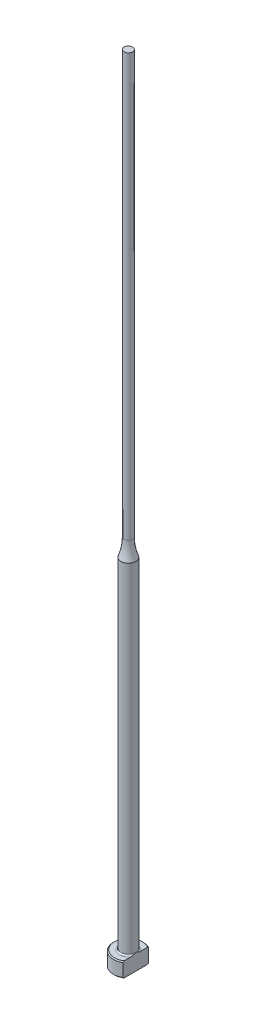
SolidWorks part; units mm, degrees
ref_plane "Front Plane" through (0, 0, 0) normal (0, 0, 1) x (1, 0, 0)
ref_plane "Top Plane" through (0, 0, 0) normal (0, 1, 0) x (1, 0, 0)
ref_plane "Right Plane" through (0, 0, 0) normal (1, 0, 0) x (0, 0, -1)
sketch "Sketch1" plane through (0, 0, 0) normal (0, 0, 1) x (1, 0, 0)
  line L0 (0, 259.9588) -> (0, -15.1925) construction
  line L1 (0, 0) -> (-3, 0)
  line L2 (-3, 0) -> (-3, 3)
  line L3 (-3, 3) -> (-1.5, 3)
  line L4 (-0.85, 75) -> (-0.85, 160)
  line L5 (-0.85, 160) -> (0, 160)
  line L6 (0, 160) -> (0, 0)
  line L7 (-1.5, 3) -> (-1.5, 71.4535)
  arc A0 (-1.5, 71.4535) -> (-0.85, 75) centre (-10.85, 75) ccw
  point P13 (-1.5, 0)
  dimension "D1" = 10
  dimension "L" = 160
  dimension "H" = 6
  dimension "T" = 3
  dimension "D" = 1.7
  dimension "B" = 3
  dimension "S" = 75
revolve "Revolve1" add sketch "Sketch1" angle 360 about L0
chamfer "Chamfer1" distance 0.2 angle 45 2 edges at (0, 3, 3) (0, 0, 3)
fillet "Fillet1" radius 0.3 1 edges at (0, 3, 1.5)
sketch "Sketch2" plane through (0, 0, 0) normal (0, 1, 0) x (1, 0, 0)
  line L0 (1.5, 2.5981) -> (1.5, -2.5981)
  circle A0 centre (0, 0) radius 3 construction
  arc A1 (1.5, -2.5981) -> (1.5, 2.5981) centre (0, 0) ccw
  circle A2 centre (0, 0) radius 1.5 construction
extrude "KEY" cut sketch "Sketch2" along normal through all
